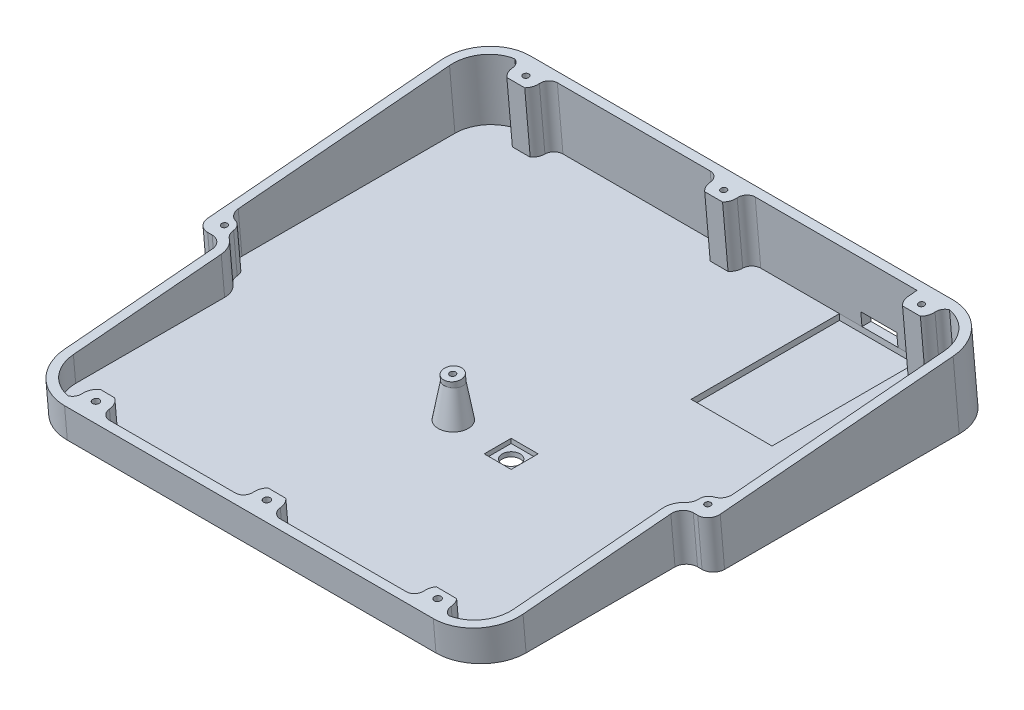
SolidWorks part; units mm, degrees
ref_plane "Front Plane" through (0, 0, 0) normal (0, 0, 1) x (1, 0, 0)
ref_plane "Top Plane" through (0, 0, 0) normal (0, 1, 0) x (1, 0, 0)
ref_plane "Right Plane" through (0, 0, 0) normal (1, 0, 0) x (0, 0, -1)
ref_plane "Plane1" through (0, 7, 0) normal (0, -1, 0) x (-1, 0, 0)
sketch "Sketch6" plane through (0, 7, 0) normal (0, -1, 0) x (-1, 0, 0)
  line L0 (0, 0) -> (-79.0032, 0) construction
ref_plane "Plane2" through (0, 6.9468, 0.6078) normal (0, -0.9962, -0.0872) x (1, 0, 0)
sketch "Sketch7" plane through (0, 6.9468, 0.6078) normal (0, -0.9962, -0.0872) x (1, 0, 0)
  line L205 (92, -10) -> (92, -43)
  line L206 (98, -100) -> (98, -48)
  line L207 (94.5, -45.5) -> (95.5, -45.5)
  line L208 (-16, -100) -> (-16, -48)
  line L209 (-12.5, -45.5) -> (-13.5, -45.5)
  line L210 (-10, -10) -> (-10, -43)
  line L211 (88, -110) -> (-6, -110)
  line L212 (82, 0) -> (0, 0)
  arc A0 (82, 0) -> (92, -10) centre (82, -10) cw
  arc A1 (98, -48) -> (95.5, -45.5) centre (95.5, -48) ccw
  arc A2 (92, -43) -> (94.5, -45.5) centre (94.5, -43) ccw
  arc A3 (98, -100) -> (88, -110) centre (88, -100) cw
  arc A4 (-16, -100) -> (-6, -110) centre (-6, -100) ccw
  arc A5 (-16, -48) -> (-13.5, -45.5) centre (-13.5, -48) cw
  arc A6 (-10, -43) -> (-12.5, -45.5) centre (-12.5, -43) cw
  arc A7 (0, 0) -> (-10, -10) centre (0, -10) ccw
  point P0 (0, 0)
  dimension "D16" = 10
  dimension "D17" = 2.5
  dimension "D18" = 10
  dimension "D19" = 82
extrude "Boss-Extrude3" add sketch "Sketch7" along normal up to surface (6.9734 mm away)
shell "Shell1" thickness 2
sketch "Sketch8" plane through (0, 6.9468, 0.6078) normal (0, 0.9962, 0.0872) x (1, 0, 0)
  line L0 (-16, 48) -> (-16, 100) construction
  line L1 (36, 108) -> (46, 108)
  line L2 (41, 106) -> (41, 108) construction
  line L3 (82, 108) -> (90, 108)
  line L4 (85, 106) -> (85, 108) construction
  line L5 (98, 100) -> (98, 48) construction
  line L6 (-8, 108) -> (2, 108)
  line L7 (94.75, 50.5) -> (96, 50.5)
  line L8 (41, 110) -> (41, 0) construction
  line L9 (-6, 110) -> (88, 110) construction
  line L10 (82, 0) -> (0, 0) construction
  line L11 (41, 55) -> (-14, 55) construction
  line L12 (-14, 100) -> (-14, 48) construction
  line L13 (36, 2) -> (46, 2)
  line L14 (-2, 2) -> (8, 2)
  line L16 (74, 2) -> (84, 2)
  line L17 (36, 2) -> (46, 2)
  line L18 (96, 48) -> (96, 100) construction
  line L19 (92.75, 48.5) -> (92.75, 47.1458)
  line L20 (96, 50.5) -> (96, 47.1458)
  line L21 (96, 47.1458) -> (92.75, 47.1458)
  line L22 (-14, 50.5) -> (-14, 47.1458)
  line L23 (-12.75, 50.5) -> (-14, 50.5)
  line L24 (-10.75, 48.5) -> (-10.75, 47.1458)
  line L25 (-14, 47.1458) -> (-10.75, 47.1458)
  line L26 (1.4418, 6.5636) -> (4.5987, 6.5386)
  line L27 (39.0335, 6.2656) -> (43.0022, 6.2341)
  line L28 (76.7346, 5.9667) -> (81.2963, 5.9305)
  line L29 (86.9843, 103.75) -> (83.0157, 103.75)
  line L30 (-1.0157, 103.75) -> (-4.9843, 103.75)
  line L31 (42.9843, 103.75) -> (39.0157, 103.75)
  line L32 (82, 106) -> (82, 108)
  circle A0 centre (-3, 106) radius 0.65
  arc A1 (-6, 106) -> (-4.9843, 103.75) centre (-3, 106) ccw
  arc A2 (-6, 106) -> (-8, 108) centre (-8, 106) ccw
  arc A3 (0, 106) -> (2, 108) centre (2, 106) cw
  arc A4 (38, 106) -> (39.0157, 103.75) centre (41, 106) ccw
  arc A5 (44, 106) -> (46, 108) centre (46, 106) cw
  arc A6 (38, 106) -> (36, 108) centre (36, 106) ccw
  circle A7 centre (41, 106) radius 0.65
  arc A8 (82, 106) -> (83.0157, 103.75) centre (85, 106) ccw
  arc A9 (88, 106) -> (90, 108) centre (90, 106) cw
  circle A11 centre (85, 106) radius 0.65
  arc A13 (38, 4) -> (36, 2) centre (36, 4) cw
  arc A14 (38, 4) -> (39.0335, 6.2656) centre (41, 4) cw
  arc A15 (44, 4) -> (46, 2) centre (46, 4) ccw
  circle A16 centre (3, 4) radius 0.75
  arc A17 (0, 4) -> (-2, 2) centre (-2, 4) cw
  arc A18 (6, 4) -> (8, 2) centre (8, 4) ccw
  arc A19 (0, 4) -> (1.4418, 6.5636) centre (3, 4) cw
  circle A20 centre (41, 4) radius 0.75
  circle A24 centre (79, 4) radius 0.75
  arc A25 (76, 4) -> (74, 2) centre (74, 4) cw
  arc A26 (82, 4) -> (84, 2) centre (84, 4) ccw
  arc A27 (76, 4) -> (76.7346, 5.9667) centre (79, 4) cw
  arc A28 (38, 4) -> (36, 2) centre (36, 4) cw
  arc A29 (38, 4) -> (44, 4) centre (41, 4) cw
  arc A30 (44, 4) -> (46, 2) centre (46, 4) ccw
  circle A31 centre (41, 45.5) radius 0.65
  circle A32 centre (41, 45.5) radius 2
  circle A33 centre (94.75, 48.5) radius 0.65
  arc A34 (94.75, 50.5) -> (92.75, 48.5) centre (94.75, 48.5) ccw
  arc A35 (94.5, 47.5) -> (90, 43) centre (94.5, 43) ccw construction
  circle A36 centre (-12.75, 48.5) radius 0.65
  arc A37 (-12.75, 50.5) -> (-10.75, 48.5) centre (-12.75, 48.5) cw
  arc A38 (81.2963, 5.9305) -> (82, 4) centre (79, 4) cw
  arc A39 (43.0022, 6.2341) -> (44, 4) centre (41, 4) cw
  arc A40 (4.5987, 6.5386) -> (6, 4) centre (3, 4) cw
  arc A41 (-1.0157, 103.75) -> (0, 106) centre (-3, 106) ccw
  arc A42 (42.9843, 103.75) -> (44, 106) centre (41, 106) ccw
  arc A43 (86.9843, 103.75) -> (88, 106) centre (85, 106) ccw
  arc A44 (82, 106) -> (80, 108) centre (80, 106) ccw
  point P10 (-3, 106)
  point P22 (-3, 106)
  point P26 (41, 45.5)
  point P31 (-3, 108)
  point P32 (0, 106)
  point P33 (-6, 106)
  point P34 (-8, 108)
  point P36 (2, 108)
  point P56 (94.75, 48.5)
  dimension "D2" = 1.3
  dimension "D5" = 6
  dimension "D4" = 2
  dimension "D3" = 2
  dimension "D6" = 3
  dimension "D11" = 3.25
  dimension "D13" = 1.3
  dimension "D14" = 4
  dimension "D15" = 1.3
  dimension "D1" = 13
  dimension "D7" = 10
  dimension "D9" = 2
  dimension "D10" = 64.5
  dimension "D12" = 48.5
  dimension "D8" = 2
extrude "Boss-Extrude4" add sketch "Sketch8" against normal up to surface (14.1827 mm away)
fillet "Fillet2" radius 2.5 4 edges at (-14, 6.6741, -50.109) (-10.75, 6.5279, -46.7548) (96, 6.6741, -50.109) (92.75, 6.5279, -46.7548)
chamfer "Chamfer1" distance 2 angle 80 1 edges at (41, 2, -43.4912)
sketch "Sketch12" plane through (0, 2, 0) normal (0, 1, 0) x (1, 0, 0)
  line L0 (72.5, 108.2376) -> (72.5, 75.2376) construction
  line L1 (63.5, 75.2376) -> (81.5, 75.2376)
  line L2 (63.5, 75.2376) -> (63.5, 108.2376)
  line L3 (63.5, 108.2376) -> (81.5, 108.2376)
  line L4 (81.5, 75.2376) -> (81.5, 108.2376)
  line L6 (98, 48.1834) -> (98, 100.382) construction
  line L7 (82, 108.2376) -> (46, 108.2376) construction
  dimension "D1" = 18
  dimension "D2" = 33
  dimension "D3" = 25.5
extrude "Cut-Extrude1" cut sketch "Sketch12" against normal blind 1.3
sketch "Sketch14" plane through (0, 0, -75.2376) normal (0, 0, -1) x (-1, 0, 0)
  line L0 (-72.5, 2) -> (-72.5, 14.3221) construction
  line L1 (-63.5, 2) -> (-81.5, 2) construction
  line L3 (-68.5, 5) -> (-76.5, 5)
  line L4 (-68.5, 5) -> (-68.5, 2)
  line L5 (-68.5, 2) -> (-76.5, 2)
  line L6 (-76.5, 5) -> (-76.5, 2)
  point P8 (-72.5, 5)
  dimension "D1" = 8
  dimension "D2" = 3
extrude "Cut-Extrude5" cut sketch "Sketch14" along normal through all
sketch "Sketch15" plane through (0, 2, 0) normal (0, 1, 0) x (1, 0, 0)
  line L0 (41, 108.9736) -> (41, -0.6078) construction
  line L1 (51, 47.7191) -> (57, 47.7191)
  line L2 (51, 47.7191) -> (51, 41.7191)
  line L3 (51, 41.7191) -> (57, 41.7191)
  line L4 (57, 47.7191) -> (57, 41.7191)
  line L5 (51, 47.7191) -> (57, 41.7191) construction
  line L6 (-6, 108.9736) -> (88, 108.9736) construction
  line L7 (82, -0.6078) -> (0, -0.6078) construction
  line L8 (41.65, 44.7191) -> (90.7583, 44.7191) construction
  ellipse E0 centre (94.5, 42.2286) end of major axis (90, 42.2286) minor radius 4.4829 (91.7681, 45.7909) -> (90, 42.2286) ccw construction
  point P6 (54, 44.7191)
  dimension "D1" = 6
  dimension "D2" = 10
extrude "Cut-Extrude6" cut sketch "Sketch15" against normal blind 1
sketch "Sketch16" plane through (0, 1, 0) normal (0, 1, 0) x (1, 0, 0)
  line L0 (51, 47.7191) -> (57, 41.7191) construction
  circle A0 centre (54, 44.7191) radius 2
  point P6 (54, 44.7191)
  dimension "D1" = 4
extrude "Cut-Extrude7" cut sketch "Sketch16" against normal through all
